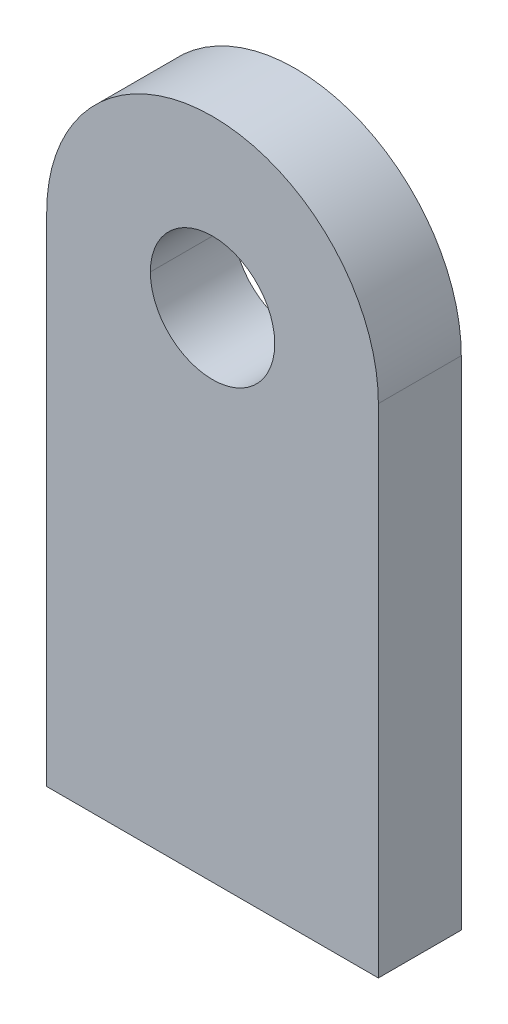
SolidWorks part; units mm, degrees
ref_plane "Front Plane" through (0, 0, 0) normal (0, 0, 1) x (1, 0, 0)
ref_plane "Top Plane" through (0, 0, 0) normal (0, 1, 0) x (1, 0, 0)
ref_plane "Right Plane" through (0, 0, 0) normal (1, 0, 0) x (0, 0, -1)
sketch "Sketch1" plane through (0, 0, 0) normal (0, 0, 1) x (1, 0, 0)
  line L0 (-25.4, 0) -> (-25.4, 76.2)
  line L1 (25.4, 76.2) -> (25.4, 0)
  line L2 (25.4, 0) -> (-25.4, 0)
  arc A0 (-25.4, 76.2) -> (25.4, 76.2) centre (0, 76.2) cw
  dimension "D1" = 25.4
  dimension "D2" = 76.2
extrude "Extrude1" add sketch "Sketch1" along normal mid plane 12.7
sketch "Sketch2" plane through (0, 0, 6.35) normal (0, 0, 1) x (1, 0, 0)
  circle A0 centre (0, 76.2) radius 9.525
  dimension "D1" = 19.05
extrude "Cut-Extrude1" cut sketch "Sketch2" against normal through all
sketch "Sketch3" plane through (0, 0, 6.35) normal (0, 0, 1) x (1, 0, 0)
  line L0 (25.4, 76.2) -> (-25.4, 76.2)
